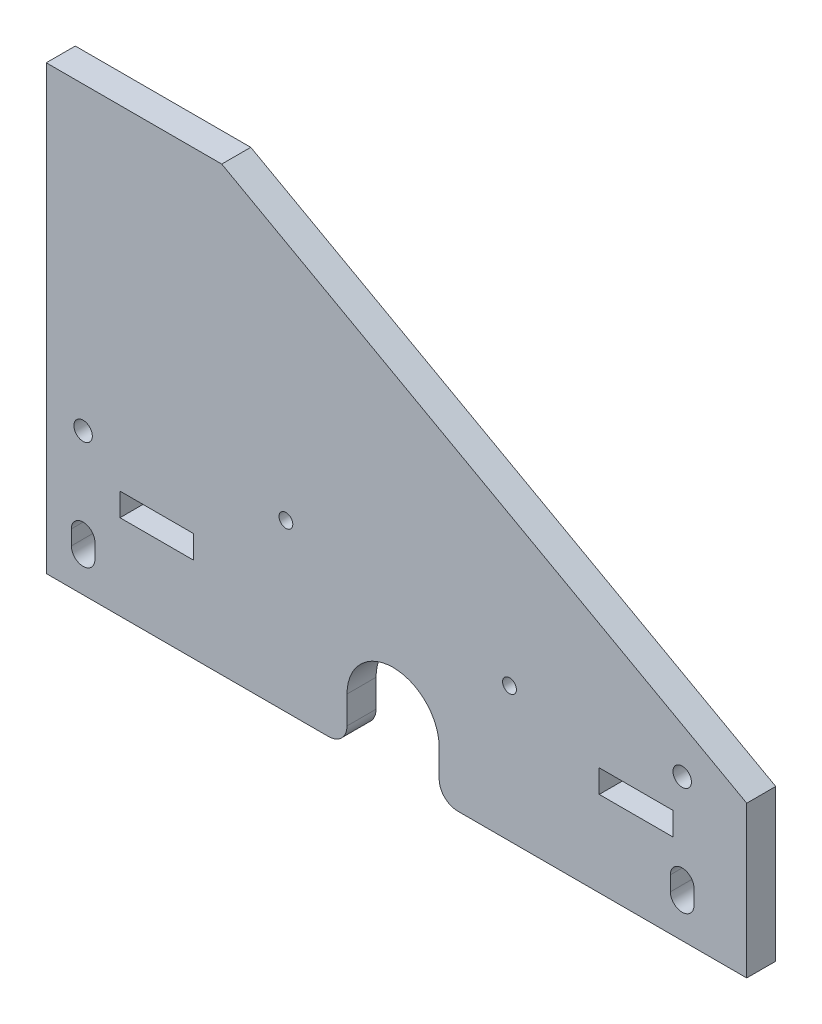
SolidWorks part; units mm, degrees
ref_plane "Front Plane" through (0, 0, 0) normal (0, 0, 1) x (1, 0, 0)
ref_plane "Top Plane" through (0, 0, 0) normal (0, 1, 0) x (1, 0, 0)
ref_plane "Right Plane" through (0, 0, 0) normal (1, 0, 0) x (0, 0, -1)
ref_plane "Plane1" through (0, 0, 10) normal (0, 0, 1) x (1, 0, 0)
sketch "Sketch1" plane through (0, 0, 10) normal (0, 0, 1) x (1, 0, 0)
  line L0 (-60.6695, -24.5819) -> (38.9214, -24.5819)
  line L1 (38.9214, -24.5819) -> (38.9214, 27.5724)
  line L2 (38.9214, 27.5724) -> (-141.9266, 127.8181)
  line L3 (-141.9266, 127.8181) -> (-202.3786, 127.8181)
  line L4 (-202.3786, 127.8181) -> (-202.3786, -24.5819)
  line L5 (-202.3786, -24.5819) -> (-105.1195, -24.5819)
  line L6 (-98.7695, -18.2319) -> (-98.7695, -8.7069)
  line L7 (-67.0195, -8.7069) -> (-67.0195, -18.2319)
  line L8 (12.6324, -12.0089) -> (12.6324, -6.9289)
  line L9 (20.7604, -6.9289) -> (20.7604, -12.0089)
  line L10 (13.5214, 12.7256) -> (13.5214, 4.7881)
  line L11 (13.5214, 4.7881) -> (-11.8786, 4.7881)
  line L12 (-11.8786, 4.7881) -> (-11.8786, 12.7256)
  line L13 (-11.8786, 12.7256) -> (13.5214, 12.7256)
  line L14 (-193.7426, -12.0089) -> (-193.7426, -6.9289)
  line L15 (-185.6146, -6.9289) -> (-185.6146, -12.0089)
  line L16 (-176.9786, 4.7881) -> (-176.9786, 12.7256)
  line L17 (-176.9786, 12.7256) -> (-151.5786, 12.7256)
  line L18 (-151.5786, 12.7256) -> (-151.5786, 4.7881)
  line L19 (-151.5786, 4.7881) -> (-176.9786, 4.7881)
  arc A0 (-67.0195, -18.2319) -> (-60.6695, -24.5819) centre (-60.6695, -18.2319) ccw
  arc A1 (-105.1195, -24.5819) -> (-98.7695, -18.2319) centre (-105.1195, -18.2319) ccw
  arc A2 (-98.7695, -8.7069) -> (-67.0195, -8.7069) centre (-82.8945, -8.7069) cw
  circle A3 centre (16.6964, 24.3588) radius 3.175
  arc A4 (20.7604, -12.0089) -> (12.6324, -12.0089) centre (16.6964, -12.0089) cw
  arc A5 (12.6324, -6.9289) -> (20.7604, -6.9289) centre (16.6964, -6.9289) cw
  circle A6 centre (-42.793, 21.7731) radius 2.3813
  circle A7 centre (-119.8286, 32.5681) radius 2.3813
  circle A8 centre (-189.6786, 24.3588) radius 3.175
  arc A9 (-185.6146, -12.0089) -> (-193.7426, -12.0089) centre (-189.6786, -12.0089) cw
  arc A10 (-193.7426, -6.9289) -> (-185.6146, -6.9289) centre (-189.6786, -6.9289) cw
extrude "Boss-Extrude1" add sketch "Sketch1" against normal blind 10
